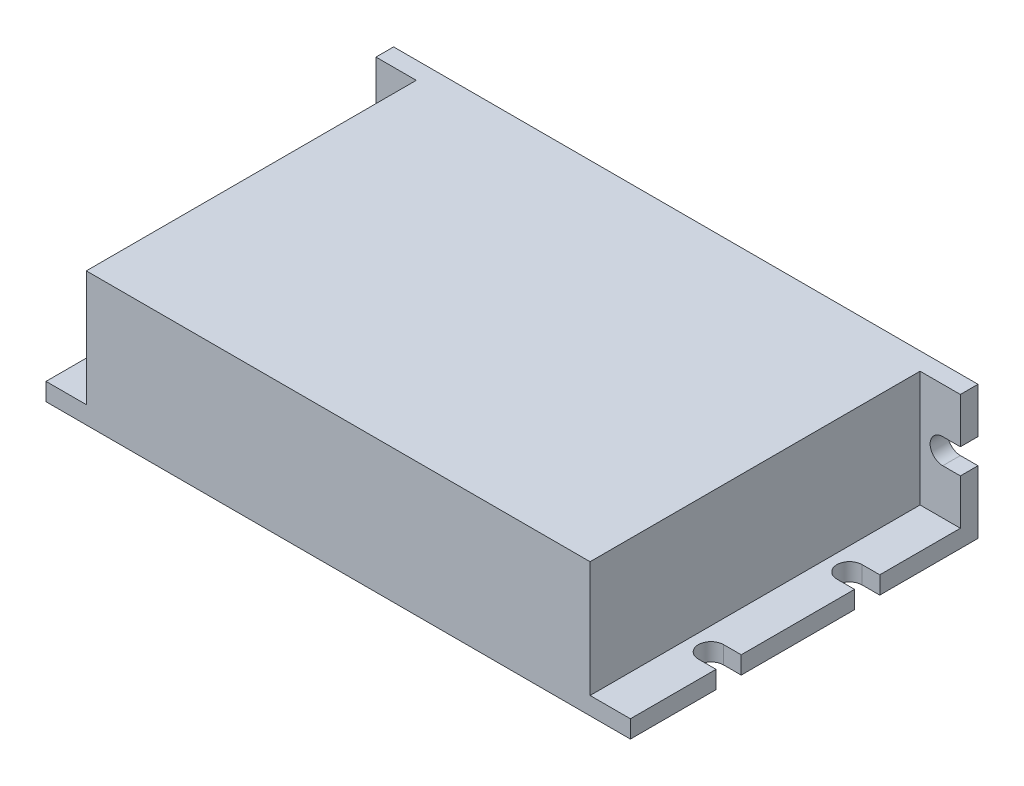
SolidWorks part; units mm, degrees
ref_plane "前视" through (0, 0, 0) normal (0, 0, 1) x (1, 0, 0)
ref_plane "上视" through (0, 0, 0) normal (0, 1, 0) x (1, 0, 0)
ref_plane "右视" through (0, 0, 0) normal (1, 0, 0) x (0, 0, -1)
sketch "草图1" plane through (0, 0, 0) normal (0, 1, 0) x (1, 0, 0)
  line L1 (0, 0) -> (116, 0)
  line L2 (0, 0) -> (0, 69)
  line L3 (0, 69) -> (116, 69)
  line L4 (116, 0) -> (116, 69)
extrude "凸台-拉伸1" add sketch "草图1" along normal blind 26.5
sketch "草图2" plane through (0, 0, 0) normal (0, 0, 1) x (1, 0, 0)
  line L1 (0, 26.5) -> (8, 26.5)
  line L2 (0, 26.5) -> (0, 3.5)
  line L3 (0, 3.5) -> (8, 3.5)
  line L4 (8, 26.5) -> (8, 3.5)
  line L5 (116, 26.5) -> (108, 26.5)
  line L6 (116, 26.5) -> (116, 3.5)
  line L7 (116, 3.5) -> (108, 3.5)
  line L8 (108, 26.5) -> (108, 3.5)
extrude "切除-拉伸1" cut sketch "草图2" against normal blind 65.5
ref_plane "基准面1" through (0, 0, -65.5) normal (0, 0, 1) x (1, 0, 0)
sketch "草图3" plane through (0, 0, -65.5) normal (0, 0, 1) x (1, 0, 0)
  line L0 (0, 26.5) -> (0, 3.5) construction
  line L3 (3.5, 17.5) -> (0, 17.5)
  line L4 (116, 3.5) -> (116, 26.5) construction
  line L7 (112.5, 17.5) -> (116, 17.5)
  line L9 (3.5, 12.5) -> (0, 12.5)
  line L10 (0, 17.5) -> (0, 12.5)
  line L11 (112.5, 12.5) -> (116, 12.5)
  line L12 (116, 17.5) -> (116, 12.5)
  arc A0 (112.5, 17.5) -> (112.5, 12.5) centre (112.5, 15) ccw
  arc A1 (3.5, 17.5) -> (3.5, 12.5) centre (3.5, 15) cw
extrude "切除-拉伸2" cut sketch "草图3" against normal blind 3.5
sketch "草图4" plane through (0, 0, 0) normal (0, 1, 0) x (1, 0, 0)
  line L0 (116, 65.5) -> (116, 0) construction
  line L2 (112.5, 49.5) -> (116, 49.5)
  line L4 (112.5, 44.5) -> (116, 44.5)
  line L5 (116, 49.5) -> (116, 44.5)
  line L7 (0, 65.5) -> (0, 0) construction
  line L8 (112.5, 22) -> (116, 22)
  line L10 (112.5, 17) -> (116, 17)
  line L11 (116, 22) -> (116, 17)
  line L12 (3.5, 49.5) -> (0, 49.5)
  line L14 (3.5, 44.5) -> (0, 44.5)
  line L15 (0, 49.5) -> (0, 44.5)
  line L17 (3.5, 22) -> (0, 22)
  line L19 (3.5, 17) -> (0, 17)
  line L20 (0, 22) -> (0, 17)
  arc A0 (3.5, 49.5) -> (3.5, 44.5) centre (3.5, 47) cw
  arc A1 (3.5, 22) -> (3.5, 17) centre (3.5, 19.5) cw
  arc A2 (112.5, 49.5) -> (112.5, 44.5) centre (112.5, 47) ccw
  arc A3 (112.5, 22) -> (112.5, 17) centre (112.5, 19.5) ccw
extrude "切除-拉伸3" cut sketch "草图4" along normal blind 3.5
